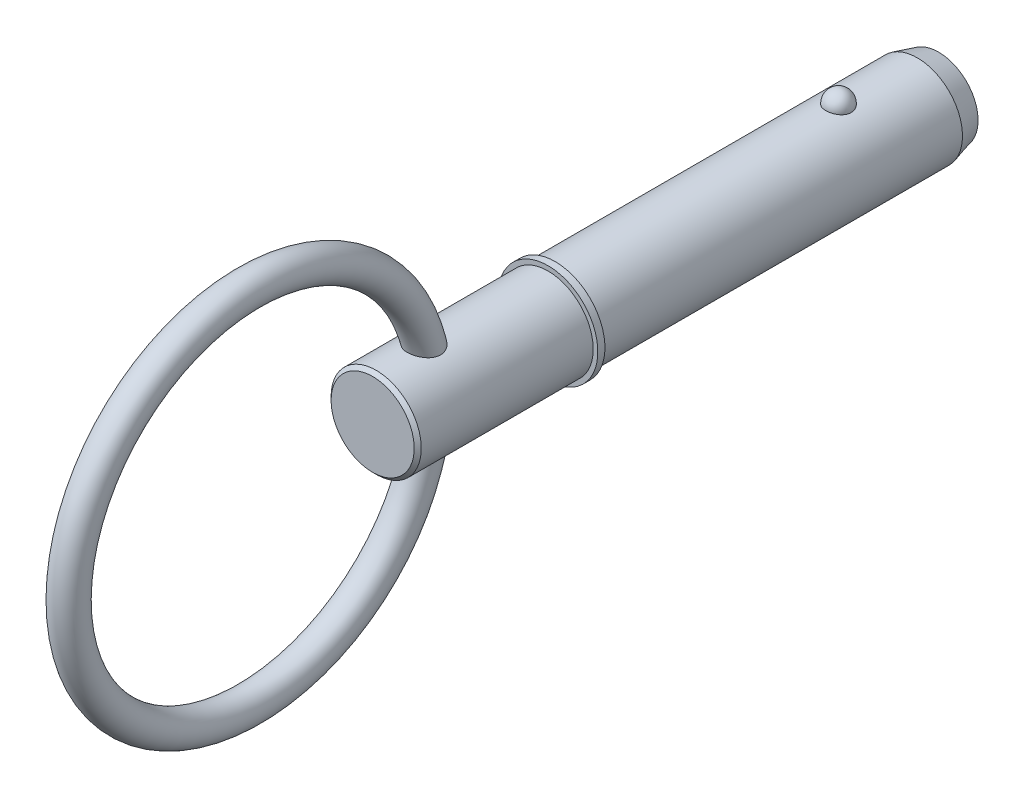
SolidWorks part; units mm, degrees
ref_plane "Front Plane" through (0, 0, 0) normal (0, 0, 1) x (1, 0, 0)
ref_plane "Top Plane" through (0, 0, 0) normal (0, 1, 0) x (1, 0, 0)
ref_plane "Right Plane" through (0, 0, 0) normal (1, 0, 0) x (0, 0, -1)
sketch "Sketch2" plane through (0, 0, 0) normal (0, 0, 1) x (1, 0, 0)
  circle A0 centre (0, 0) radius 6.35
  point P3 (0, 6.35)
  dimension "D1" = 12.7
extrude "Boss-Extrude1" add sketch "Sketch2" along normal blind 38.1
sketch "Sketch3" plane through (0, 0, 0) normal (0, 0, -1) x (-1, 0, 0)
  circle A0 centre (0, 0) radius 6.35
  dimension "D1" = 12.7
extrude "Boss-Extrude2" add sketch "Sketch3" along normal blind 15.88
chamfer "Chamfer1" distance 3 angle 15 1 edges at (-6.35, 0, -15.88)
sketch "Sketch18" plane through (0, 0, 0) normal (1, 0, 0) x (0, 0, -1)
  line L0 (12.88, 6.35) -> (-38.1, 6.35) construction
  line L1 (1.78, 8.13) -> (1.78, 4.57)
  line L2 (-38.1, -6.35) -> (12.88, -6.35) construction
  arc A0 (1.78, 8.13) -> (1.78, 4.57) centre (1.78, 6.35) ccw
  point P4 (0, 6.35)
  dimension "D1" = 14.48
revolve "Revolve1" add sketch "Sketch18" angle 360 about L1
sketch "Sketch19" plane through (0, 0, 0) normal (1, 0, 0) x (0, 0, -1)
  line L0 (-33.7288, 0) -> (-46.4542, 0) construction
sketch "Sketch20" plane through (0, 0, 0) normal (1, 0, 0) x (0, 0, -1)
  line L0 (-38.1, 0) -> (-38.1, 7)
  line L1 (-38.1, 6.35) -> (-38.1, -6.35) construction
  line L2 (-38.1, 7) -> (-39.1, 7)
  line L3 (-39.1, 7) -> (-39.1, 0)
  line L4 (-33.7288, 0) -> (-46.4542, 0) construction
  line L5 (-39.1, 0) -> (-38.1, 0)
  dimension "D1" = 7
  dimension "D2" = 1
revolve "Revolve2" add sketch "Sketch20" angle 360 about L0
sketch "Sketch21" plane through (0, 0, 38.1) normal (0, 0, -1) x (-1, 0, 0)
  circle A0 centre (0, 0) radius 6.35
  dimension "D1" = 12.7
extrude "Boss-Extrude3" add sketch "Sketch21" against normal blind 25.7
chamfer "Chamfer2" distance 0.5 angle 45 1 edges at (-6.35, 0, 63.8)
sketch "Sketch23" plane through (0, 0, 0) normal (1, 0, 0) x (0, 0, -1)
  line L0 (-63.8, 5.85) -> (-63.8, -5.85) construction
  circle A0 centre (-81.2, 0) radius 25.4
  point P2 (-55.8, 0)
  dimension "D1" = 50.8
  dimension "D2" = 8
sketch "Sketch24" plane through (0, 0, 0) normal (0, 1, 0) x (1, 0, 0)
  circle A0 centre (0, -55.8) radius 2.25
  dimension "D1" = 4.5
sweep "Sweep1" add profiles "Sketch24" path "Sketch23"
